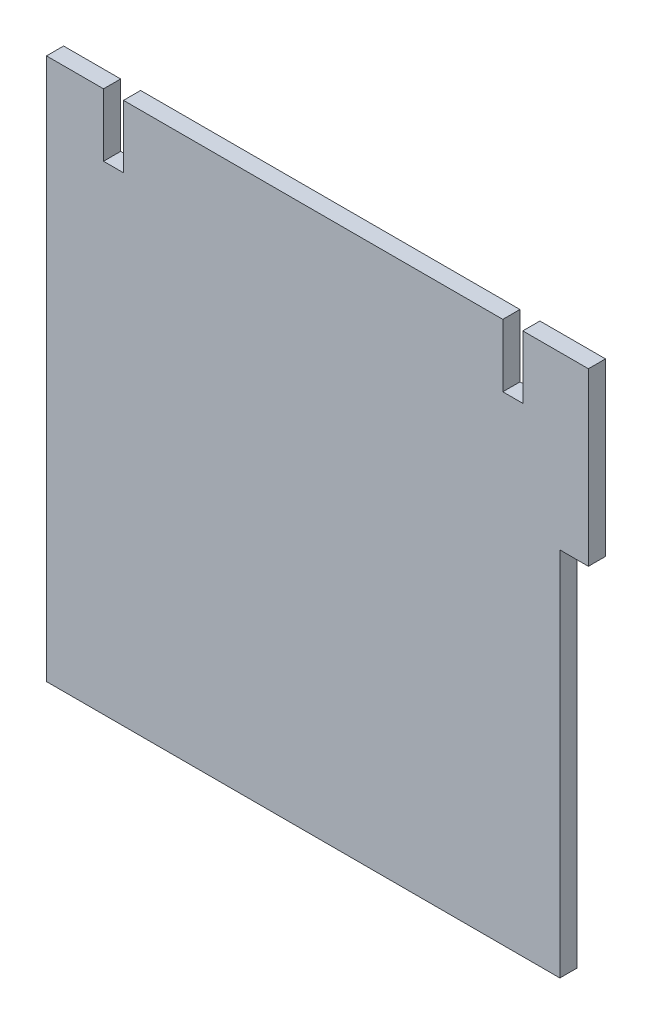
SolidWorks part; units mm, degrees
ref_plane "Plan de face" through (0, 0, 0) normal (0, 0, 1) x (1, 0, 0)
ref_plane "Plan de dessus" through (0, 0, 0) normal (0, 1, 0) x (1, 0, 0)
ref_plane "Plan de droite" through (0, 0, 0) normal (1, 0, 0) x (0, 0, -1)
sketch "Esquisse1" plane through (0, 0, 0) normal (0, 0, 1) x (1, 0, 0)
  line L1 (0, 0) -> (95, 0)
  line L2 (0, 0) -> (0, 95)
  line L3 (0, 95) -> (95, 95)
  line L4 (95, 0) -> (95, 95)
  dimension "D1" = 95
  dimension "D2" = 95
extrude "Extrusion1" add sketch "Esquisse1" along normal blind 3
sketch "Esquisse2" plane through (0, 0, 3) normal (0, 0, 1) x (1, 0, 0)
  line L0 (95, 95) -> (0, 95) construction
  line L1 (10, 95) -> (13.5, 95)
  line L2 (10, 95) -> (10, 84)
  line L3 (10, 84) -> (13.5, 84)
  line L4 (13.5, 95) -> (13.5, 84)
  line L5 (95, 0) -> (95, 95) construction
  line L6 (80, 95) -> (83.5, 95)
  line L7 (80, 95) -> (80, 84)
  line L8 (80, 84) -> (83.5, 84)
  line L9 (83.5, 95) -> (83.5, 84)
  line L10 (95, 65) -> (90, 65)
  line L11 (95, 65) -> (95, 0)
  line L12 (95, 0) -> (90, 0)
  line L13 (90, 65) -> (90, 0)
  dimension "D1" = 3.5
  dimension "D2" = 3.5
  dimension "D3" = 11
  dimension "D4" = 11
  dimension "D5" = 10
  dimension "D6" = 11.5
  dimension "D7" = 5
  dimension "D8" = 65
extrude "Enlèv. mat.-Extru.1" cut sketch "Esquisse2" against normal blind 3
